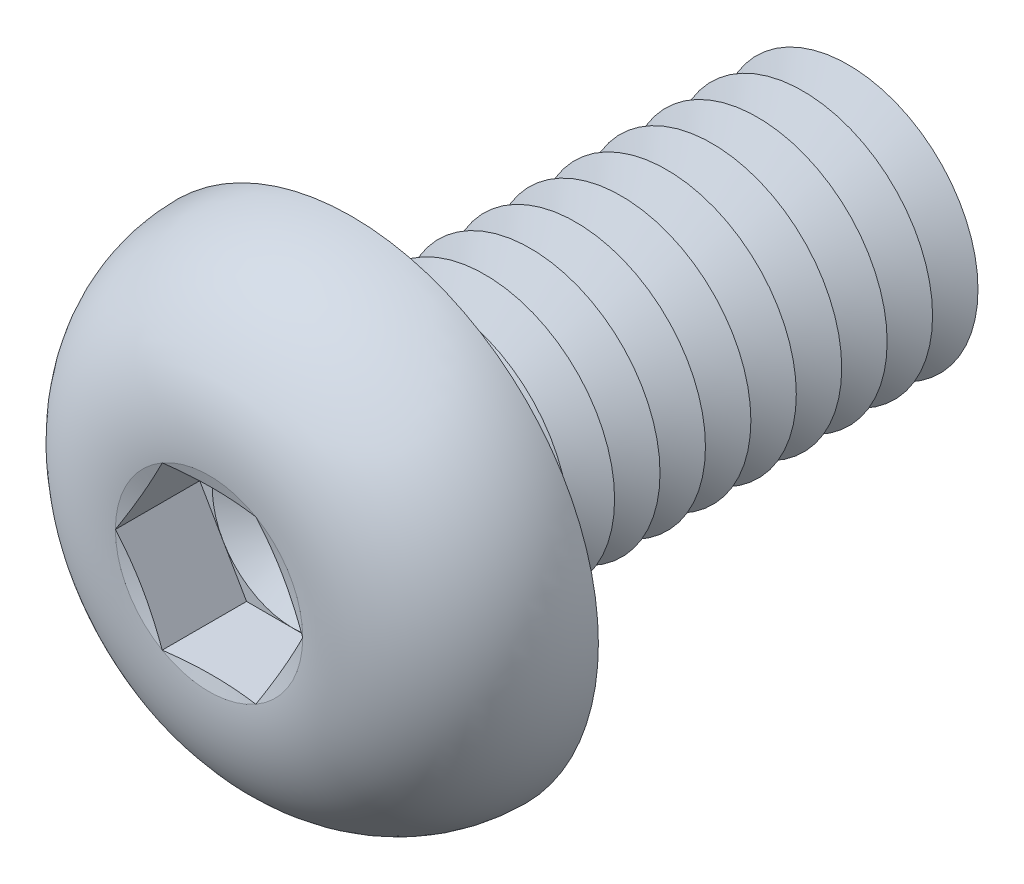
SolidWorks part; units mm, degrees
ref_plane "Front Plane" through (0, 0, 0) normal (0, 0, 1) x (1, 0, 0)
ref_plane "Top Plane" through (0, 0, 0) normal (0, 1, 0) x (1, 0, 0)
ref_plane "Right Plane" through (0, 0, 0) normal (1, 0, 0) x (0, 0, -1)
sketch "Sketch1" plane through (0, 0, 0) normal (1, 0, 0) x (0, 0, -1)
  line L0 (0, 2) -> (0, 3.8)
  line L3 (0, 2) -> (8, 2)
  line L4 (8, 2) -> (8, 0)
  line L5 (8, 0) -> (-2.2, 0) construction
  line L6 (-2.2, 0) -> (8, 0)
  line L7 (-2.2, 1.4434) -> (-2.2, 0.7217) construction
  line L8 (-2.2, 0.7217) -> (-2.2, 0)
  line L9 (-2.2, 1.4434) -> (-2.0066, 0.7217)
  line L10 (-2.0066, 0.7217) -> (-2.2, 0.7217)
  line L11 (8, 0) -> (22.7481, 0) construction
  line L12 (0, 3.8) -> (-2.2, 3.8) construction
  arc A1 (0, 3.8) -> (-2.2, 1.4434) centre (0, 1.5948) ccw
  point P8 (8, 1)
  dimension "D1" = 7.6
  dimension "D2" = 4
  dimension "D3" = 2.2
  dimension "D4" = 2.8868
  dimension "D5" = 8
  dimension "D6" = 15
revolve "Revolve1" add sketch "Sketch1" angle 360 about L5
fillet "Fillet1" radius 0.35 1 edges at (-2, 0, 0)
sketch "Sketch2" plane through (0, 0, 0) normal (1, 0, 0) x (0, 0, -1)
  line L0 (7.65, 2) -> (8.35, 2)
  line L1 (8, 2) -> (0.35, 2) construction
  line L2 (8.35, 2) -> (8, 1.3938)
  line L3 (8, -2) -> (8, 2) construction
  line L4 (8, 1.3938) -> (7.65, 2)
  dimension "D1" = 0.7
revolve "Cut-Revolve1" cut sketch "Sketch2" angle 360 about axis through (0, 0, -8) along (0, 0, -1)
pattern_linear "LPattern1" count 11 spacing 0.7 along (0, 0, 1) of "Cut-Revolve1"
sketch "Sketch3" plane through (0, 0, 2.2) normal (0, 0, 1) x (1, 0, 0)
  line L7 (0.7217, 1.25) -> (-0.7217, 1.25)
  line L8 (-0.7217, 1.25) -> (-1.4434, 0)
  line L9 (-1.4434, 0) -> (-0.7217, -1.25)
  line L10 (-0.7217, -1.25) -> (0.7217, -1.25)
  line L11 (0.7217, -1.25) -> (1.4434, 0)
  line L12 (1.4434, 0) -> (0.7217, 1.25)
  circle A0 centre (0, 0) radius 1.25 construction
  circle A3 centre (0, 0) radius 1.4434 construction
extrude "Cut-Extrude1" cut sketch "Sketch3" against normal blind 1.3
sketch "Sketch4" plane through (0, 0, 0.9) normal (0, 0, 1) x (1, 0, 0)
  line L1 (0.7217, 1.25) -> (-0.7217, 1.25) construction
  circle A0 centre (0, 0) radius 1.25
extrude "Cut-Extrude2" cut sketch "Sketch4" against normal through all draft 60
